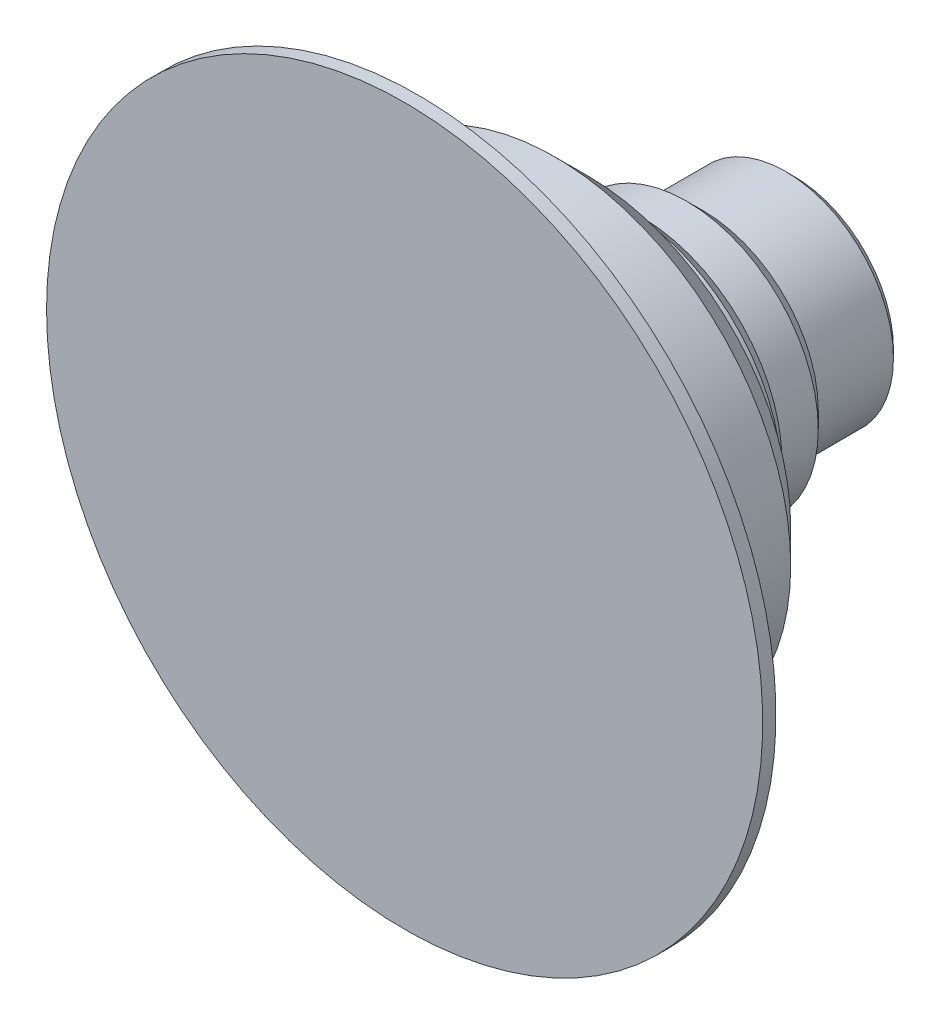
SolidWorks part; units mm, degrees
ref_plane "Front Plane" through (0, 0, 0) normal (0, 0, 1) x (1, 0, 0)
ref_plane "Top Plane" through (0, 0, 0) normal (0, 1, 0) x (1, 0, 0)
ref_plane "Right Plane" through (0, 0, 0) normal (1, 0, 0) x (0, 0, -1)
other "Center of Mass"
sketch "Sketch1" plane through (0, 0, 0) normal (0, 1, 0) x (1, 0, 0)
  line L17 (0, 0) -> (27.0891, 0)
  line L18 (27.0891, 0) -> (27.0891, 1)
  line L19 (27.0891, 1) -> (19.4691, 1)
  line L20 (19.4691, 1) -> (19.4691, 3.1734)
  line L21 (19.4691, 3.1734) -> (17.8435, 3.1734)
  line L22 (17.8435, 3.1734) -> (17.8435, 13.9032)
  line L23 (11.9761, 13.9032) -> (17.8435, 13.9032)
  line L24 (0, 13.9032) -> (0, 0)
  line L25 (11.9761, 13.9032) -> (11.9761, 17.8402)
  line L26 (11.9761, 17.8402) -> (9.9695, 17.8402)
  line L27 (9.9695, 17.8402) -> (9.9695, 22.59)
  line L28 (11.9761, 13.9032) -> (0, 13.9032) construction
  line L29 (9.9695, 22.59) -> (8.1661, 22.59)
  line L30 (8.1661, 22.59) -> (8.1661, 29.448)
  line L31 (8.1661, 29.448) -> (3.429, 29.448)
  line L32 (3.429, 29.448) -> (3.429, 28.94)
  line L33 (3.429, 28.94) -> (0, 28.94)
  line L34 (0, 28.94) -> (0, 13.9032)
  dimension "D1" = 27.0891
  dimension "D2" = 1
  dimension "D3" = 7.62
  dimension "D4" = 2.1734
  dimension "D5" = 1.6256
  dimension "D6" = 12.9032
  dimension "D7" = 11.9761
  dimension "D8" = 3.937
  dimension "D9" = 9.9695
  dimension "D10" = 4.7498
  dimension "D11" = 8.1661
  dimension "D12" = 6.858
  dimension "D13" = 3.429
  dimension "D14" = 0.508
revolve "Revolve1" add sketch "Sketch1" angle 360 about L24
chamfer "Chamfer1" distance 2.54 angle 45 1 edges at (-17.8435, 0, -13.9032)
chamfer "Chamfer2" distance 1.27 angle 45 2 edges at (-9.9695, 0, -22.59) (-11.9761, 0, -17.8402)
chamfer "Chamfer3" distance 0.635 angle 45 1 edges at (-8.1661, 0, -29.448)
sketch "Sketch2" plane through (0, 0, -1) normal (0, 0, -1) x (-1, 0, 0)
  text T0 "35mm"
extrude "Cut-Extrude1" cut sketch "Sketch2" against normal blind 0.254
